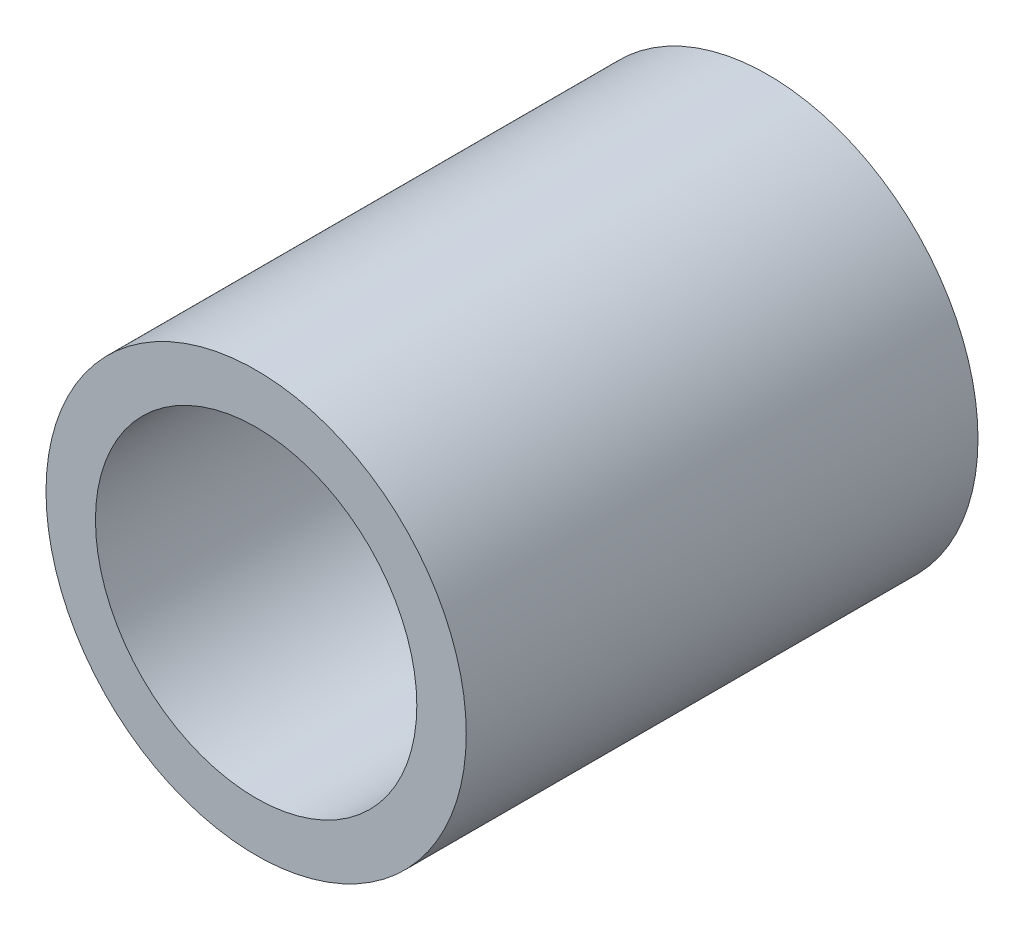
SolidWorks part; units mm, degrees
ref_plane "Plan1" through (0, 0, 0) normal (0, 0, 1) x (1, 0, 0)
ref_plane "Plan2" through (0, 0, 0) normal (0, 1, 0) x (1, 0, 0)
ref_plane "Plan3" through (0, 0, 0) normal (1, 0, 0) x (0, 0, -1)
sketch "Esquisse1" plane through (0, 0, 0) normal (0, 0, 1) x (1, 0, 0)
  circle A0 centre (0, 0) radius 8.5
  dimension "D1" = 17
extrude "Base-Extru.-Mince" add sketch "Esquisse1" along normal blind 20.7 thin
